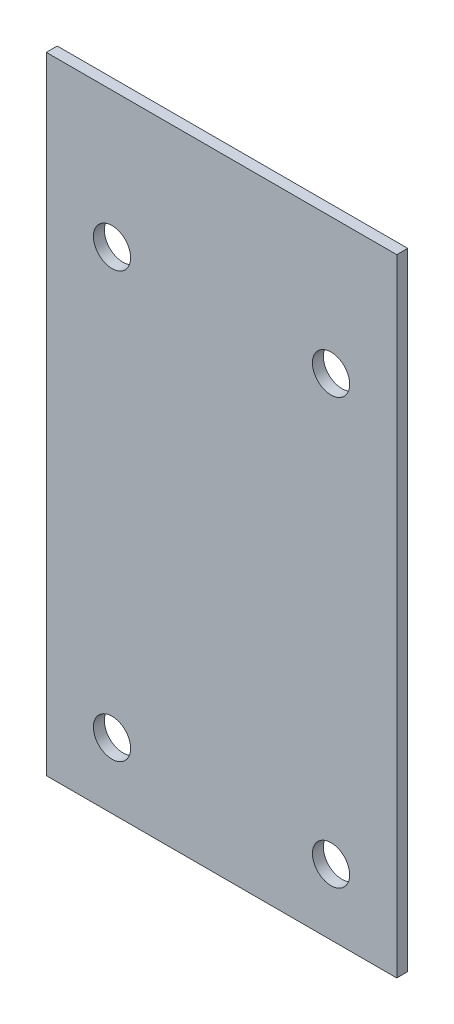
SolidWorks part; units mm, degrees
ref_plane "Plan de face" through (0, 0, 0) normal (0, 0, 1) x (1, 0, 0)
ref_plane "Plan de dessus" through (0, 0, 0) normal (0, 1, 0) x (1, 0, 0)
ref_plane "Plan de droite" through (0, 0, 0) normal (1, 0, 0) x (0, 0, -1)
sketch "Esquisse1" plane through (0, 0, 0) normal (1, 0, 0) x (0, 0, -1)
  line L0 (0, 143) -> (0, 0)
  dimension "D2" = 143
sheet metal parameters "Tôlerie 1" thickness 2.5 parameters "D1"=2.5
base flange "Tôle de base pliée1" sketch "Esquisse1" end condition mid plane depth 80 reverse direction no thickness 2.5 reverse thickness direction no bend radius 2.5
hole_wizard "Dégagement M101" positions "Esquisse4" profile "Esquisse3" hole size "M10" standard "ISO"
sketch "Esquisse4" plane through (0, 0, 0) normal (0, 0, -1) x (-1, 0, 0)
  line L2 (-40, 143) -> (-40, 0) construction
  line L3 (-40, 0) -> (40, 0) construction
  point P0 (-25, 112)
  point P1 (25, 112)
  point P2 (-25, 15)
  point P3 (25, 15)
  dimension "D1" = 15
  dimension "D2" = 15
  dimension "D3" = 97
  dimension "D4" = 50
  dimension "D5" = 97
sketch "Esquisse3" plane through (25, 112, 0) normal (1, 0, 0) x (0, 1, 0)
  line L0 (0, 0) -> (0, 2.5)
  line L1 (0, 2.5) -> (4.25, 2.5)
  line L2 (4.25, 2.5) -> (4.25, 0)
  line L5 (4.25, 0) -> (0, 0)
  line L11 (0, -6.35) -> (0, 107.95) construction
  dimension "Diamètre du perçage jusqu'au prochain" = 8.5
  dimension "Profondeur du perçage jusqu'au prochain" = 2.5
flat pattern "Etat déplié1"
sketch "Lignes de pliage1" plane through (0, 0, 0) normal (0, 1, 0) x (-1, 0, 0)
